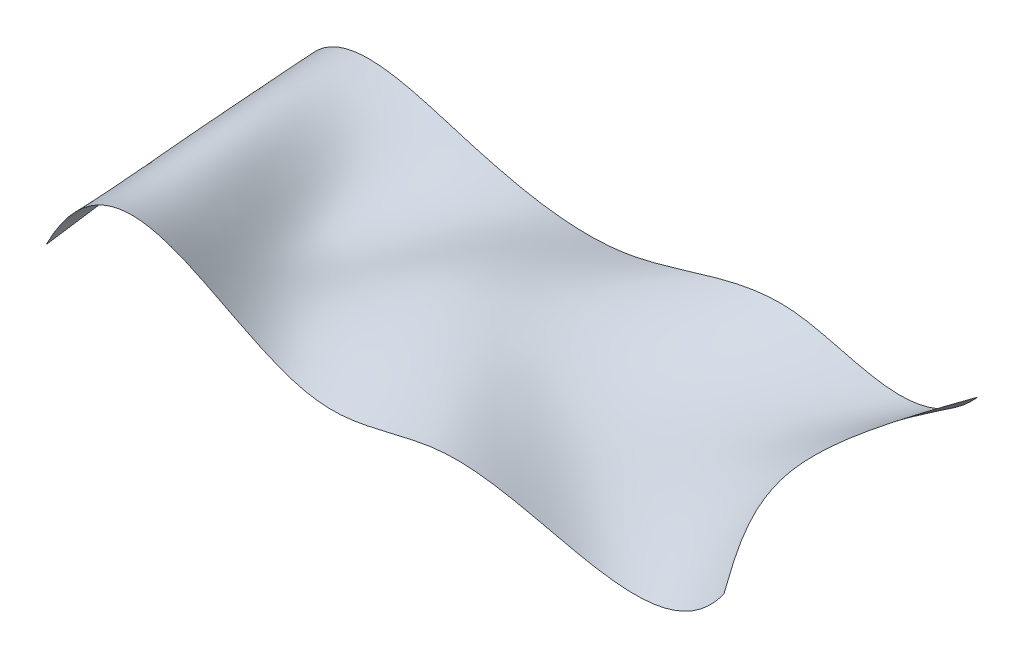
SolidWorks part; units mm, degrees
ref_plane "Front Plane" through (0, 0, 0) normal (0, 0, 1) x (1, 0, 0)
ref_plane "Top Plane" through (0, 0, 0) normal (0, 1, 0) x (1, 0, 0)
ref_plane "Right Plane" through (0, 0, 0) normal (1, 0, 0) x (0, 0, -1)
sketch "Sketch1" plane through (0, 0, 0) normal (0, 0, 1) x (1, 0, 0)
  spline S0 degree 3 poles (-42.2287, 0) (-31.3501, 21.4195) (-11.633, -7.018) (21.684, 8.529) (44.2094, -8.156) (53.6948, 5.1737) knots 0 0 0 0 0.429975 0.594973 1 1 1 1
ref_plane "Plane1" through (0, 0, -20) normal (0, 0, 1) x (1, 0, 0)
sketch "Sketch2" plane through (0, 0, -20) normal (0, 0, 1) x (1, 0, 0)
  spline S0 degree 3 poles (-44.6797, 0) (-35.2442, 13.9077) (-28.0751, -6.99) (-6.7497, 6.5565) (15.7019, -3.3622) (34.1532, 0.5709) (43.6341, 5.4917) knots 0 0 0 0 0.225511 0.418372 0.645953 1 1 1 1
ref_plane "Plane2" through (0, 0, -40) normal (0, 0, 1) x (1, 0, 0)
sketch "Sketch3" plane through (0, 0, -40) normal (0, 0, 1) x (1, 0, 0)
  spline S0 degree 3 poles (-46.1546, 0) (-41.2548, 8.9296) (-22.9419, 1.8597) (0.1049, -2.706) (24.2434, 9.9714) (40.8216, -2.5457) (49.6512, 7.2792) knots 0 0 0 0 0.256269 0.487872 0.725211 1 1 1 1
other "Boundary-Surface1"
